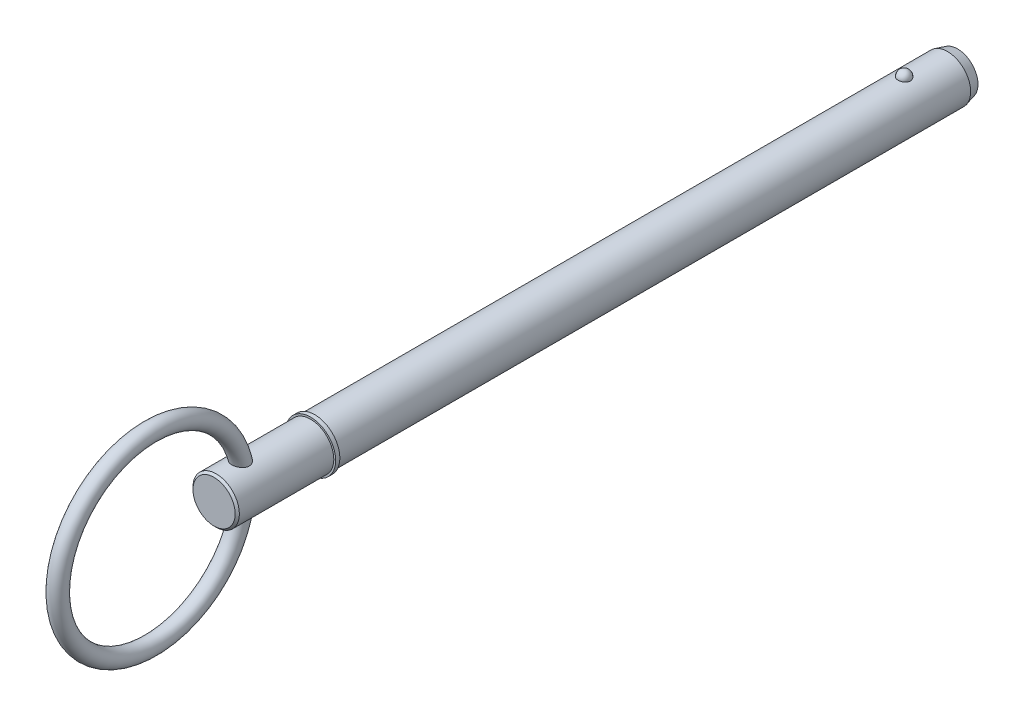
SolidWorks part; units mm, degrees
ref_plane "Front Plane" through (0, 0, 0) normal (0, 0, 1) x (1, 0, 0)
ref_plane "Top Plane" through (0, 0, 0) normal (0, 1, 0) x (1, 0, 0)
ref_plane "Right Plane" through (0, 0, 0) normal (1, 0, 0) x (0, 0, -1)
sketch "Sketch2" plane through (0, 0, 0) normal (0, 0, 1) x (1, 0, 0)
  circle A0 centre (0, 0) radius 5.555
  point P3 (0, 5.555)
  dimension "D1" = 11.11
extrude "Boss-Extrude1" add sketch "Sketch2" along normal blind 139.7
sketch "Sketch3" plane through (0, 0, 0) normal (0, 0, -1) x (-1, 0, 0)
  circle A0 centre (0, 0) radius 5.555
  dimension "D1" = 11.11
extrude "Boss-Extrude2" add sketch "Sketch3" along normal blind 14.27
chamfer "Chamfer1" distance 2.4 angle 15 1 edges at (-5.555, 0, -14.27)
sketch "Sketch18" plane through (0, 0, 0) normal (1, 0, 0) x (0, 0, -1)
  line L0 (11.87, 5.555) -> (-139.7, 5.555) construction
  line L1 (1.49, 7.045) -> (1.49, 4.065)
  line L2 (-139.7, -5.555) -> (11.87, -5.555) construction
  arc A0 (1.49, 7.045) -> (1.49, 4.065) centre (1.49, 5.555) ccw
  point P4 (0, 5.555)
  dimension "D1" = 12.6
revolve "Revolve1" add sketch "Sketch18" angle 360 about L1
sketch "Sketch19" plane through (0, 0, 0) normal (1, 0, 0) x (0, 0, -1)
  line L0 (-33.7288, 0) -> (-46.4542, 0) construction
sketch "Sketch20" plane through (0, 0, 0) normal (1, 0, 0) x (0, 0, -1)
  line L0 (-139.7, 0) -> (-139.7, 6)
  line L1 (-139.7, 5.555) -> (-139.7, -5.555) construction
  line L2 (-139.7, 6) -> (-140.7, 6)
  line L3 (-140.7, 6) -> (-140.7, 0)
  line L4 (-33.7288, 0) -> (-46.4542, 0) construction
  line L5 (-140.7, 0) -> (-139.7, 0)
  dimension "D1" = 6
  dimension "D2" = 1
revolve "Revolve2" add sketch "Sketch20" angle 360 about L0
sketch "Sketch21" plane through (0, 0, 139.7) normal (0, 0, -1) x (-1, 0, 0)
  circle A0 centre (0, 0) radius 5.555
  dimension "D1" = 11.11
extrude "Boss-Extrude3" add sketch "Sketch21" against normal blind 24.13
chamfer "Chamfer2" distance 0.5 angle 45 1 edges at (-5.555, 0, 163.83)
sketch "Sketch23" plane through (0, 0, 0) normal (1, 0, 0) x (0, 0, -1)
  line L0 (-163.83, 5.055) -> (-163.83, -5.055) construction
  circle A0 centre (-179.055, 0) radius 22.225
  point P2 (-156.83, 0)
  dimension "D1" = 44.45
  dimension "D2" = 7
sketch "Sketch24" plane through (0, 0, 0) normal (0, 1, 0) x (1, 0, 0)
  circle A0 centre (0, -156.83) radius 2
  dimension "D1" = 4
sweep "Sweep1" add profiles "Sketch24" path "Sketch23"
